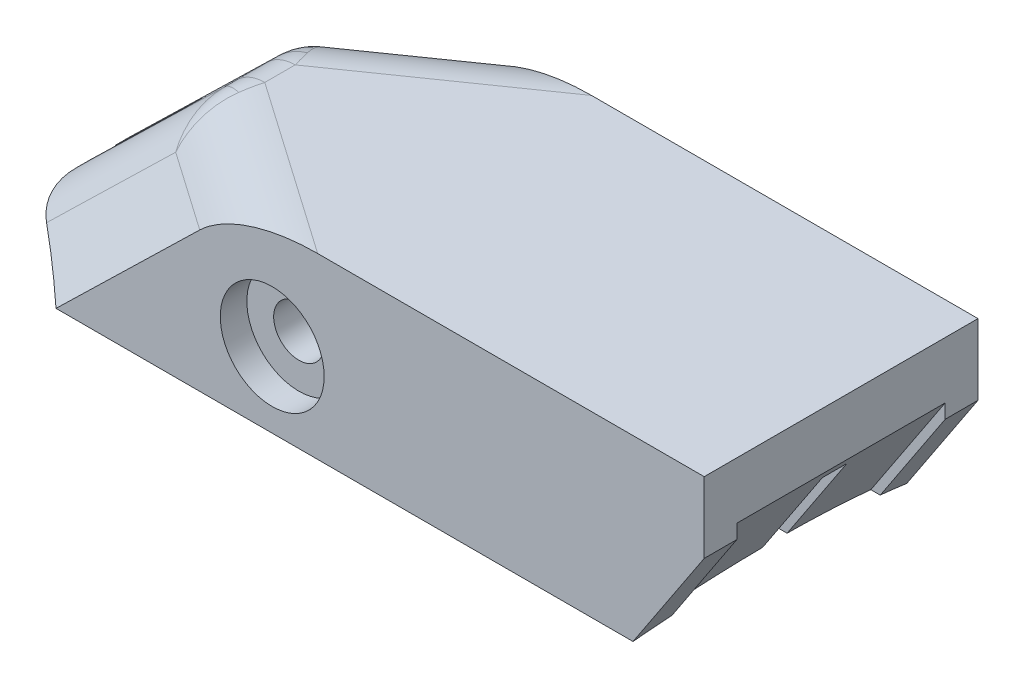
SolidWorks part; units mm, degrees
ref_plane "Front Plane" through (0, 0, 0) normal (0, 0, 1) x (1, 0, 0)
ref_plane "Top Plane" through (0, 0, 0) normal (0, 1, 0) x (1, 0, 0)
ref_plane "Right Plane" through (0, 0, 0) normal (1, 0, 0) x (0, 0, -1)
sketch "Sketch1" plane through (0, 0, 0) normal (0, 0, 1) x (1, 0, 0)
  line L0 (76.2, 19.05) -> (19.5895, 19.05)
  line L1 (19.5895, 19.05) -> (0, 0)
  line L3 (0, 0) -> (76.2, 0)
  line L4 (76.2, 19.05) -> (76.2, 0)
  dimension "D1" = 19.05
extrude "Extrude1" add sketch "Sketch1" along normal blind 17.78
sketch "Sketch2" plane through (0, 0, 0) normal (1, 0, 0) x (0, 0, -1)
  line L0 (-8.89, 19.05) -> (-8.89, 0) construction
  line L1 (-17.78, 19.05) -> (0, 19.05) construction
  line L2 (-17.78, 0) -> (0, 0) construction
  line L3 (-8.89, 14.732) -> (-8.89, -0.3597) construction
  line L4 (-9.6837, -0.3597) -> (-8.0962, -0.3597)
  line L5 (-9.6837, -0.3597) -> (-9.6837, 14.732)
  line L6 (-9.6837, 14.732) -> (-8.0962, 14.732)
  line L7 (-8.0962, -0.3597) -> (-8.0962, 14.732)
  dimension "D1" = 1.5875
  dimension "D2" = 4.318
extrude "Cut-Extrude1" cut sketch "Sketch2" along normal through all
chamfer "Chamfer3" distance 5.08 angle 45 2 edges at (9.7947, 9.525, 0) (9.7947, 9.525, 17.78)
fillet "Fillet7" radius 2.54 1 edges at (19.5895, 19.05, 8.89)
fillet "Fillet8" radius 5.08 3 edges at (9.425, 9.1655, 12.7) (19.6652, 18.8634, 12.8866) (23.7485, 19.05, 15.5995)
fillet "Fillet9" radius 5.08 3 edges at (9.425, 9.1655, 5.08) (19.6652, 18.8634, 4.8934) (23.7485, 19.05, 2.1805)
sketch "Sketch3" plane through (0, 0, 0) normal (0, 0, 1) x (1, 0, 0)
  line L0 (57.0562, 19.05) -> (57.0562, 14.4526)
  line L1 (76.2, 19.05) -> (31.9571, 19.05) construction
  line L2 (57.0562, 14.4526) -> (47.2252, -0.4005)
  line L3 (47.2252, -0.4005) -> (78.4511, -0.4005)
  line L4 (78.4511, -0.4005) -> (78.4511, 19.05)
  line L5 (78.4511, 19.05) -> (57.0562, 19.05)
  dimension "D1" = 4.5974
  dimension "D2" = 56.5
extrude "Cut-Extrude5" cut sketch "Sketch3" along normal through all
sketch "Sketch4" plane through (0, 0, 17.78) normal (0, 0, 1) x (1, 0, 0)
  line L0 (52.3153, 7.2898) -> (14.7829, 7.2898) construction
  line L1 (57.0562, 14.4526) -> (47.4903, 0) construction
  line L2 (24.3004, 16.5452) -> (7.2866, 0) construction
  line L4 (-1.5714, 7.2898) -> (61.2148, 7.2898)
  line L5 (-1.5714, 7.2898) -> (-1.5714, -0.7785)
  line L6 (-1.5714, -0.7785) -> (61.2148, -0.7785)
  line L7 (61.2148, 7.2898) -> (61.2148, -0.7785)
  dimension "D1" = 7.1628
extrude "Cut-Extrude6" cut sketch "Sketch4" against normal through all
sketch "Sketch6" plane through (0, 0, 17.78) normal (0, 0, 1) x (1, 0, 0)
  line L0 (52.4162, 7.4422) -> (14.9396, 7.4422) construction
  line L2 (57.0562, 14.4526) -> (52.3153, 7.2898) construction
  line L3 (24.3004, 16.5452) -> (14.7829, 7.2898) construction
  line L4 (52.3153, 7.2898) -> (14.7829, 7.2898) construction
  dimension "D1" = 0.1524
sketch "Sketch7" plane through (0, 0, 0) normal (1, 0, 0) x (0, 0, -1)
  line L0 (-8.89, 14.732) -> (-8.89, -15.6811) construction
  line L1 (-8.0962, 14.732) -> (-9.6837, 14.732) construction
  circle A0 centre (-8.89, -19.6889) radius 28.575
  dimension "D1" = 57.15
extrude "Cut-Extrude8" cut sketch "Sketch7" along normal through all
sketch "Sketch9" plane through (33.0231, -21.8575, 0) normal (0.8339, -0.5519, 0) x (0, 0, -1)
  line L1 (-8.89, 44.8948) -> (-8.89, 34.7785) construction
  line L2 (-15.6523, 44.8948) -> (-2.1277, 44.8948)
  line L3 (-15.6523, 44.8948) -> (-15.6523, 34.7785)
  line L4 (-15.6523, 34.7785) -> (-2.1277, 34.7785)
  line L5 (-2.1277, 44.8948) -> (-2.1277, 34.7785)
extrude "Cut-Extrude9" cut sketch "Sketch9" against normal blind 0.508
hole_wizard "CBORE for #4 Binding Head Machine Screw1" positions "3DSketch2" profile "Sketch11" counterbore size "#4" standard "Ansi Inch"
sketch3d "3DSketch2"
  point P0 (29.0055, 12.3407, 17.78)
sketch "Sketch11" plane through (29.0055, 12.3407, 17.78) normal (1, 0, 0) x (0, -1, 0)
  line L0 (0, 0) -> (0, 8.0962)
  line L1 (0, 8.0962) -> (1.6319, 8.0962)
  line L3 (1.6319, 8.0962) -> (1.632, 1.7272)
  line L4 (1.632, 1.7272) -> (3.3731, 1.7272)
  line L5 (3.3731, 1.7272) -> (3.3731, 0)
  line L7 (3.3731, 0) -> (0, 0)
  line L11 (0, -6.35) -> (0, 107.95) construction
  dimension "Thru Hole Dia." = 3.2639
  dimension "Thru Hole Depth" = 8.0962
  dimension "C'Bore Dia." = 6.7462
  dimension "C'Bore Depth" = 1.7272
